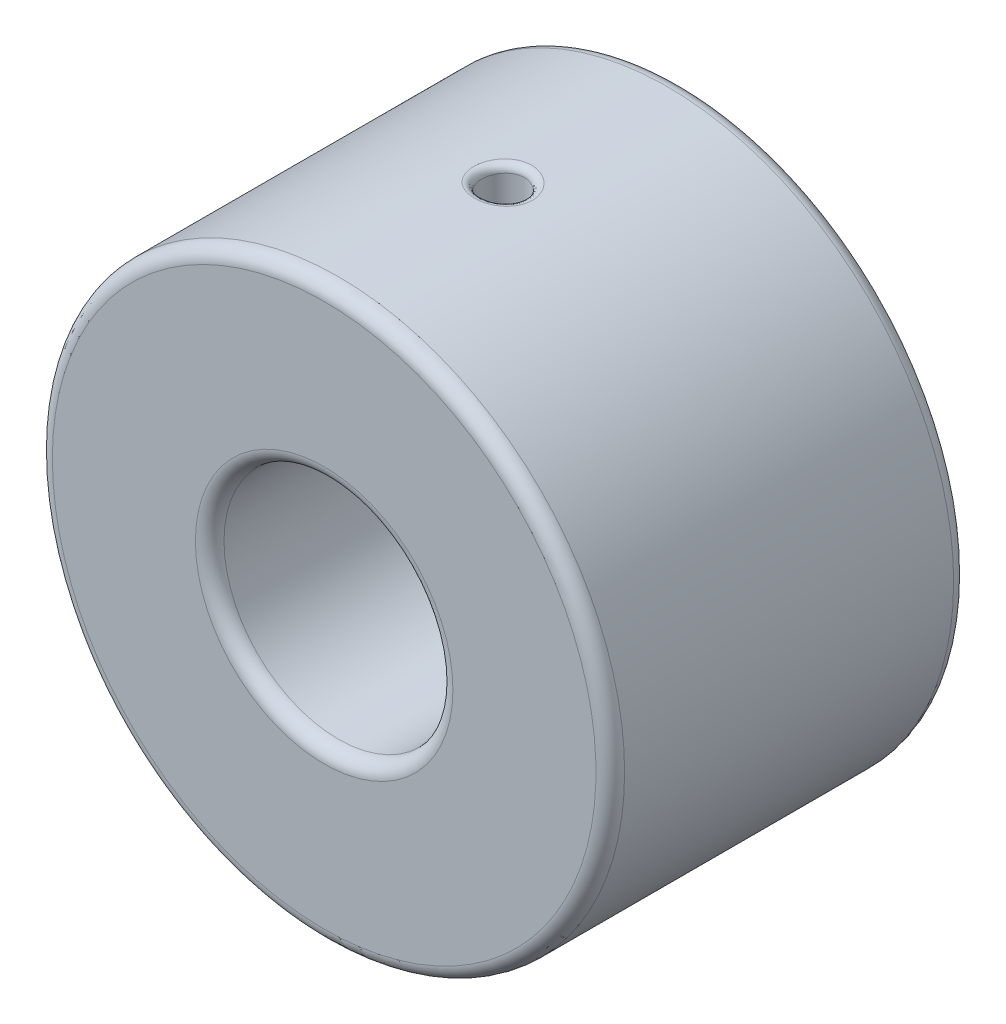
SolidWorks part; units mm, degrees
ref_plane "Спереди" through (0, 0, 0) normal (0, 0, 1) x (1, 0, 0)
ref_plane "Сверху" through (0, 0, 0) normal (0, 1, 0) x (1, 0, 0)
ref_plane "Справа" through (0, 0, 0) normal (1, 0, 0) x (0, 0, -1)
sketch "Эскиз1" plane through (0, 0, 0) normal (1, 0, 0) x (0, 0, -1)
  line L0 (-6.25, 0) -> (6.25, 0) construction
  line L1 (-6.25, 4) -> (6.25, 4)
  line L2 (6.25, 4) -> (6.25, 10)
  line L3 (6.25, 10) -> (-6.25, 10)
  line L4 (-6.25, 10) -> (-6.25, 4)
  dimension "D1" = 12.5
  dimension "D2" = 8
  dimension "D3" = 20
revolve "Повернуть1" add sketch "Эскиз1" angle 360 about L0
fillet "Скругление1" radius 0.5 4 edges at (10, 0, -6.25) (10, 0, 6.25) (4, 0, 6.25) (4, 0, -6.25)
sketch "Эскиз2" plane through (0, 0, 0) normal (0, 1, 0) x (1, 0, 0)
  circle A0 centre (0, 0) radius 0.75
  dimension "D1" = 1.5
extrude "Вырез-Вытянуть1" cut sketch "Эскиз2" against normal mid plane 20
fillet "Скругление2" radius 0.25 4 edges at (0.1578, -3.9969, -0.7332) (-0.1578, 3.9969, -0.7332) (-0.1701, -9.9986, -0.7304) (0.1701, 9.9986, -0.7304)
